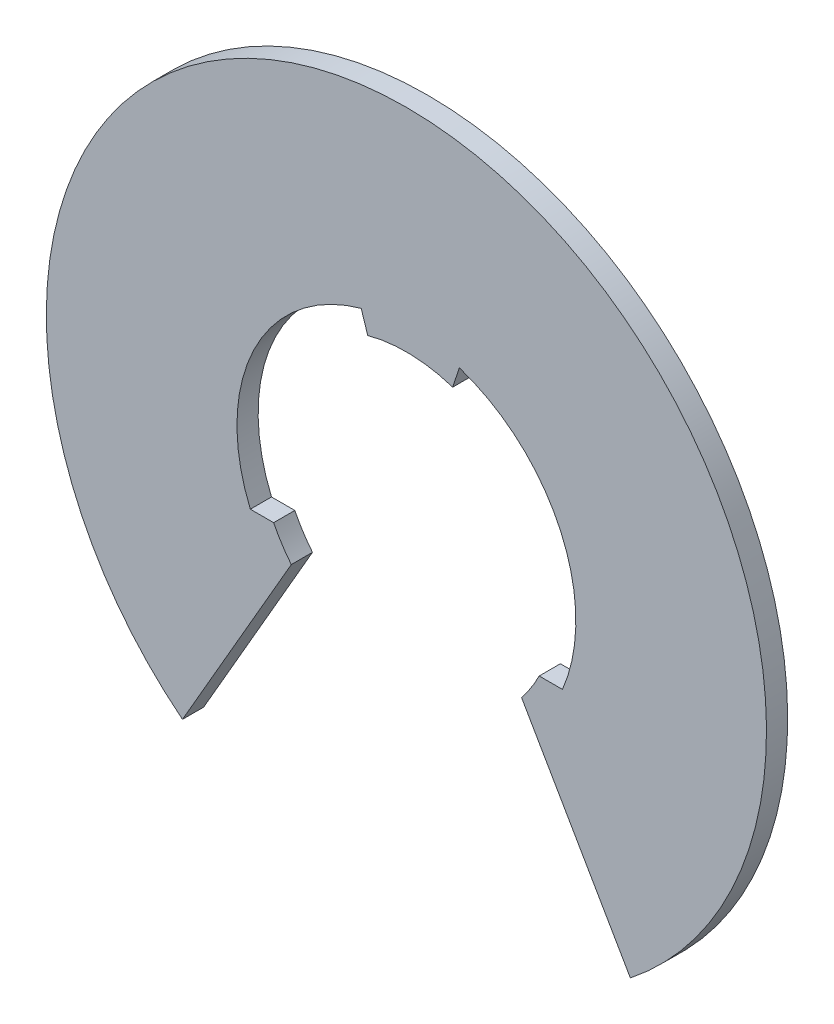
SolidWorks part; units mm, degrees
ref_plane "XY" through (0, 0, 0) normal (0, 0, 1) x (1, 0, 0)
ref_plane "XZ" through (0, 0, 0) normal (0, 1, 0) x (1, 0, 0)
ref_plane "YZ" through (0, 0, 0) normal (1, 0, 0) x (0, 0, -1)
sketch "Esquisse1" plane through (0, 0, 0) normal (0, 0, 1) x (1, 0, 0)
  line L0 (-1.0869, -0.8825) -> (-1.1908, -1.0625)
  line L1 (0, 0.9554) -> (0, -0.9554) construction
  line L2 (1.0869, -0.8825) -> (1.1908, -1.0625)
  line L3 (-1.2536, -0.6232) -> (-1.4736, -0.6232)
  line L4 (1.2536, -0.6232) -> (1.4736, -0.6232)
  line L5 (-0.4268, 1.542) -> (-0.3649, 1.3516)
  line L6 (0.4371, 1.33) -> (0.4996, 1.52)
  line L7 (-1.1908, -1.0625) -> (-2.1145, -2.6625)
  line L8 (1.1908, -1.0625) -> (2.1145, -2.6625)
  circle A0 centre (0, 0) radius 1.4 construction
  arc A1 (1.0869, -0.8825) -> (1.2536, -0.6232) centre (0, 0) ccw
  arc A2 (1.4736, -0.6232) -> (0.4996, 1.52) centre (0, 0) ccw
  arc A3 (2.1145, -2.6625) -> (-2.1145, -2.6625) centre (0, 0) ccw
  arc A4 (-1.2536, -0.6232) -> (-1.0869, -0.8825) centre (0, 0) ccw
  circle A5 centre (0, 0) radius 1.6 construction
  circle A6 centre (0, 0) radius 1.4 construction
  arc A7 (0.4371, 1.33) -> (-0.3649, 1.3516) centre (0, 0) ccw
  arc A8 (-0.4268, 1.542) -> (-1.4736, -0.6232) centre (0, 0) ccw
  circle A10 centre (0, 0) radius 3.4 construction
  point P4 (1.3388, 0.4093)
  point P13 (1.6, 0)
  point P23 (3.4, 0)
  dimension "D3" = 30
  dimension "D4" = 30
  dimension "D5" = 0.18
  dimension "D6" = 0.18
  dimension "D7" = 0.22
  dimension "D8" = 0.19
  dimension "D9" = 18
  dimension "D10" = 0.1904
  dimension "D11" = 1.6
  dimension "D12" = 1.6
  dimension "D1" = 0.2
  dimension "D2" = 2
extrude "Boss.-Extru.1" add sketch "Esquisse1" along normal blind 0.2
